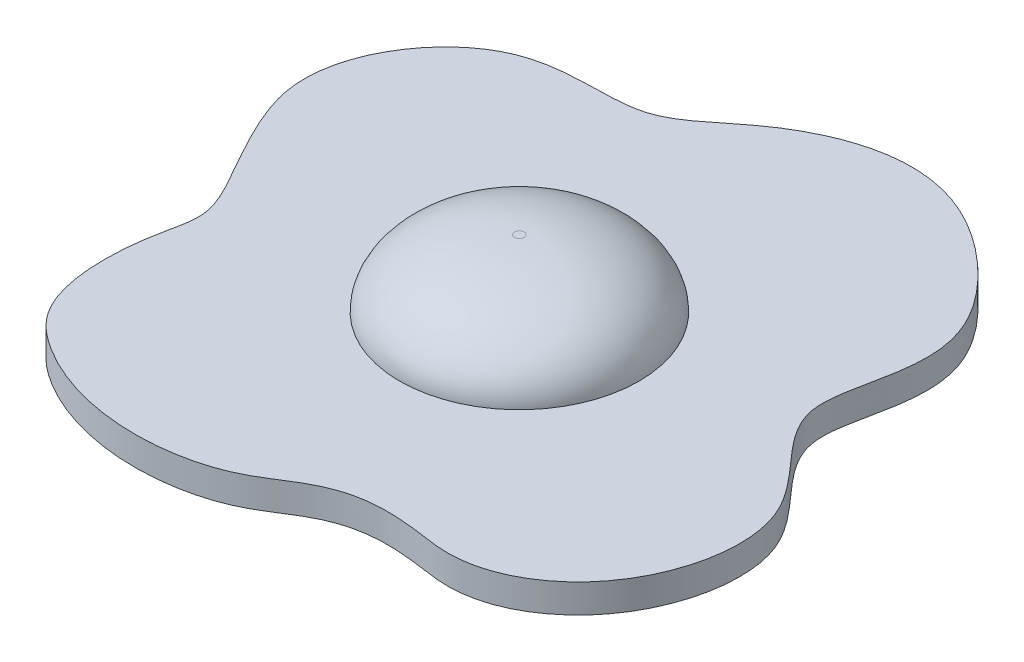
SolidWorks part; units mm, degrees
ref_plane "Front Plane" through (0, 0, 0) normal (0, 0, 1) x (1, 0, 0)
ref_plane "Top Plane" through (0, 0, 0) normal (0, 1, 0) x (1, 0, 0)
ref_plane "Right Plane" through (0, 0, 0) normal (1, 0, 0) x (0, 0, -1)
sketch "Sketch1" plane through (0, 0, 0) normal (0, 1, 0) x (1, 0, 0)
  circle A0 centre (0, 0) radius 12.5
extrude "Boss-Extrude1" add sketch "Sketch1" along normal blind 10
fillet "Fillet1" radius 7 1 edges at (0, 10, 12.5)
sketch "Sketch2" plane through (0, 0, 0) normal (0, 1, 0) x (1, 0, 0)
  circle A0 centre (0, 0) radius 35 construction
  spline S0 degree 3 poles (-9.7888, 22.331) (-4.2458, 31.6457) (12.259, 35.6038) (29.3808, 19.724) (19.9506, 4.9438) (34.5294, -2.9833) (31.2929, -20.1236) (21.0063, -26.3522) (6.3987, -23.5909) (1.075, -31.7251) (-15.9831, -32.1242) (-26.9623, -23.2992) (-26.4444, -11.7952) (-24.2388, -6.7096) (-29.9976, 1.0221) (-34.0777, 12.9094) (-25.0767, 26.2603) (-9.7888, 22.331) (-4.2458, 31.6457) (12.259, 35.6038) knots -0.243458 -0.158312 -0.081033 0 0.051242 0.090702 0.147482 0.205088 0.258669 0.304158 0.319627 0.413358 0.54251 0.564443 0.632684 0.680163 0.74039 0.756542 0.841688 0.918967 1 1.051242 1.090702 1.147482 only from (0, 31.9074) to (0, 31.9074)
  point P5 (-31.5895, 5.751)
  point P7 (-25.6341, -6.3765)
  point P9 (24.1752, 6.4007)
  point P11 (24.5, 21.7766)
  point P13 (0, 0)
extrude "Boss-Extrude2" add sketch "Sketch2" along normal blind 3
